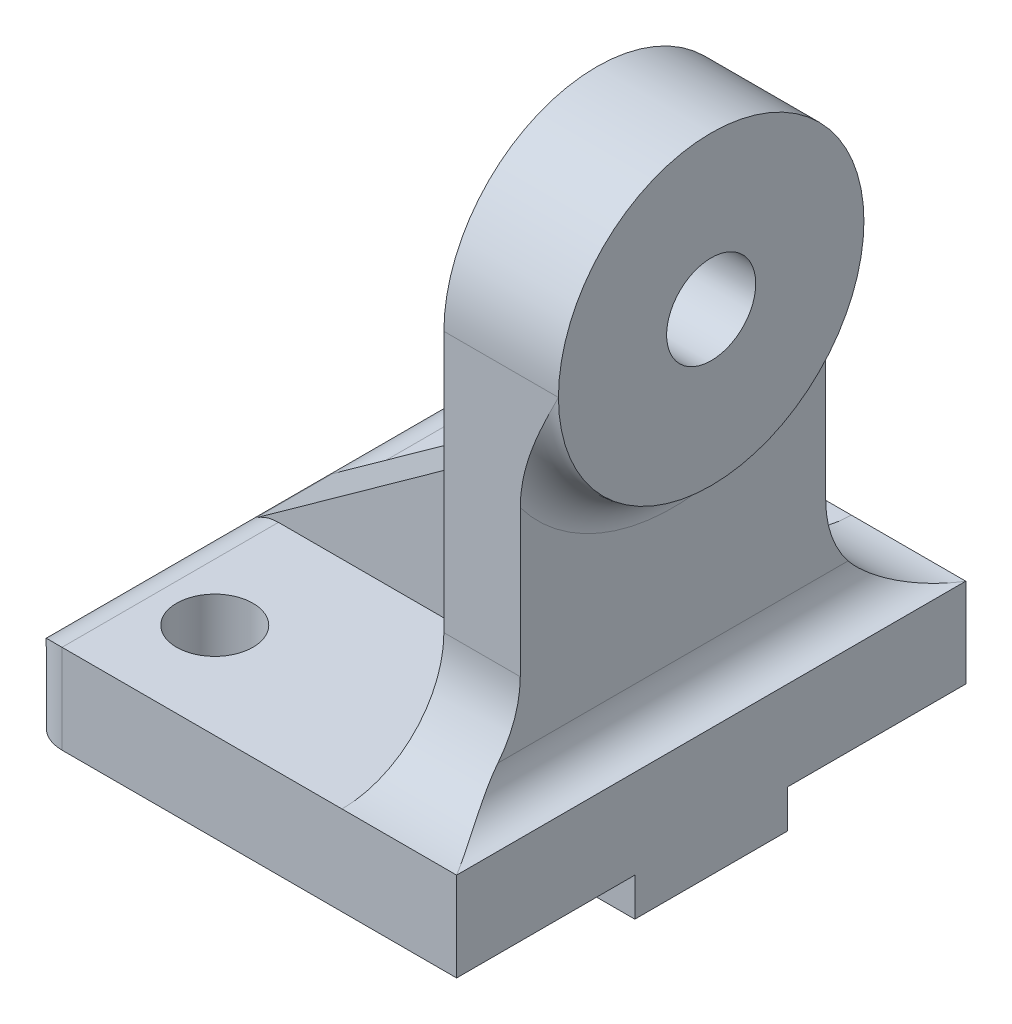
SolidWorks part; units mm, degrees
ref_plane "Front" through (0, 0, 0) normal (0, 0, 1) x (1, 0, 0)
ref_plane "Top" through (0, 0, 0) normal (0, 1, 0) x (1, 0, 0)
ref_plane "Right" through (0, 0, 0) normal (1, 0, 0) x (0, 0, -1)
sketch "Sketch1" plane through (0, 0, 0) normal (0, 1, 0) x (1, 0, 0)
  line L1 (6, 0) -> (68, 0)
  line L2 (0, 6) -> (0, 74)
  line L3 (6, 80) -> (68, 80)
  line L4 (68, 0) -> (68, 80)
  arc A0 (0, 74) -> (6, 80) centre (6, 74) cw
  arc A1 (6, 0) -> (0, 6) centre (6, 6) cw
  circle A2 centre (15, 65) radius 6
  circle A3 centre (15, 15) radius 6
  point P9 (0, 0)
  dimension "D3" = 6
  dimension "D4" = 12
  dimension "D5" = 15
  dimension "D6" = 15
  dimension "D7" = 15
  dimension "D8" = 15
  dimension "D1" = 80
  dimension "D2" = 68
extrude "Extrude1" add sketch "Sketch1" along normal blind 14
sketch "Sketch2" plane through (0, 0, 0) normal (0, -1, 0) x (1, 0, 0)
  line L0 (68, -40) -> (0, -40) construction
  line L1 (68, 0) -> (68, -80) construction
  line L2 (0, -74) -> (0, -6) construction
  line L3 (68, -28) -> (0, -28)
  line L4 (68, -52) -> (0, -52)
  line L5 (68, -28) -> (68, -52)
  line L6 (0, -28) -> (0, -52)
extrude "Extrude2" add sketch "Sketch2" along normal blind 6
sketch "Sketch3" plane through (0, -6, 0) normal (0, -1, 0) x (1, 0, 0)
  line L0 (0, -40) -> (68, -40) construction
  line L1 (0, -28) -> (0, -52) construction
  line L2 (68, -52) -> (68, -28) construction
  point P6 (34, -40)
  dimension "D1" = 34
hole_wizard "M8 Tapped Hole1" positions "3DSketch1" profile "Sketch4" tap size "M8" standard "ISO"
sketch3d "3DSketch1"
  point P0 (34, -6, -40)
sketch "Sketch4" plane through (34, -6, -40) normal (1, 0, 0) x (0, 0, -1)
  line L0 (0, 0) -> (0, 17.7929)
  line L1 (0, 17.7929) -> (3.4, 15.75)
  line L2 (3.4, 15.75) -> (3.4, 12)
  line L3 (3.4, 12) -> (4, 12)
  line L4 (4, 12) -> (4, 0)
  line L5 (4, 0) -> (0, 0)
  line L10 (0, 17.7929) -> (-3.4, 15.75) construction
  line L11 (0, -6.35) -> (0, 107.95) construction
  dimension "Tap Drill Dia." = 6.8
  dimension "Tap Drill Depth" = 15.75
  dimension "Thread Major Dia." = 8
  dimension "Thread Depth" = 12
  dimension "Drill Angle" = 118
sketch "Sketch5" plane through (68, 0, 0) normal (1, 0, 0) x (0, 0, -1)
  line L0 (40, 14) -> (40, 71) construction
  line L1 (0, 14) -> (80, 14) construction
  line L2 (16, 71) -> (16, 30)
  line L3 (64, 71) -> (64, 30)
  line L4 (0, 14) -> (80, 14)
  arc A0 (64, 71) -> (16, 71) centre (40, 71) ccw
  circle A1 centre (40, 71) radius 7
  arc A2 (0, 14) -> (16, 30) centre (0, 30) ccw
  arc A3 (64, 30) -> (80, 14) centre (80, 30) ccw
  dimension "D1" = 57
  dimension "D3" = 14
  dimension "D4" = 32
extrude "Extrude3" add sketch "Sketch5" against normal blind 18
sketch "Sketch6" plane through (68, 0, 0) normal (1, 0, 0) x (0, 0, -1)
  line L0 (0, 14) -> (80, 14)
  line L1 (16, 71) -> (16, 30)
  line L2 (64, 71) -> (64, 30)
  arc A0 (16, 71) -> (64, 71) centre (40, 71) ccw
  arc A1 (0, 14) -> (16, 30) centre (0, 30) ccw
  arc A2 (64, 30) -> (80, 14) centre (80, 30) ccw
extrude "Cut-Extrude1" cut sketch "Sketch6" against normal blind 6
fillet "Fillet1" radius 6 2 edges at (62, 47, -40) (62, 14, -40)
ref_plane "Plane1" through (0, 0, -40) normal (0, 0, 1) x (1, 0, 0)
fillet "Fillet5" radius 6 1 edges at (0, 14, -40)
sketch "Sketch7" plane through (0, 0, -40) normal (0, 0, 1) x (1, 0, 0)
  line L0 (50, 47) -> (2.4991, 12.8728)
  line L1 (50, 71) -> (50, 30) construction
  line L2 (50, 47) -> (50, 14)
  line L3 (50, 14) -> (68, 14) construction
  line L4 (50, 14) -> (6, 14)
  arc A0 (6, 14) -> (2.4991, 12.8728) centre (6, 8) ccw
extrude "Extrude4" add sketch "Sketch7" along normal mid plane 12
fillet "Fillet6" radius 6 2 edges at (50, 30.5, -46) (50, 30.5, -34)
